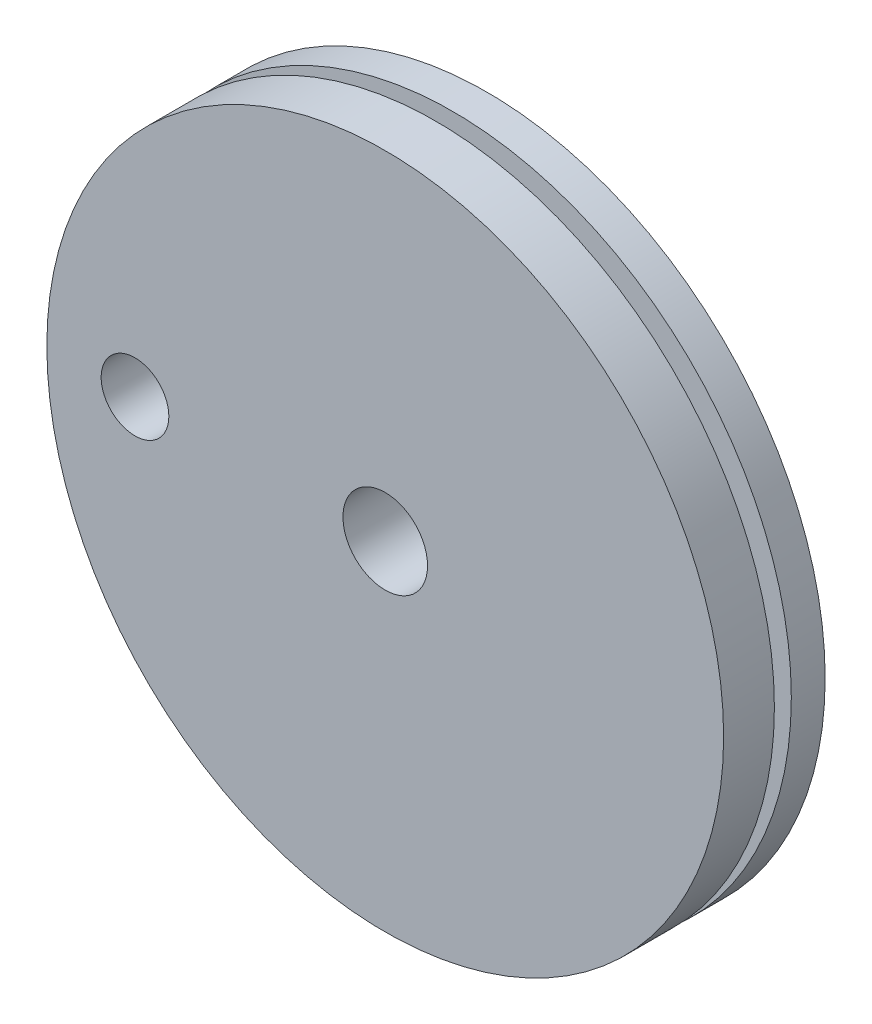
SolidWorks part; units mm, degrees
ref_plane "Plan de face" through (0, 0, 0) normal (0, 0, 1) x (1, 0, 0)
ref_plane "Plan de dessus" through (0, 0, 0) normal (0, 1, 0) x (1, 0, 0)
ref_plane "Plan de droite" through (0, 0, 0) normal (1, 0, 0) x (0, 0, -1)
sketch "Esquisse1" plane through (0, 0, 0) normal (0, 0, 1) x (1, 0, 0)
  circle A0 centre (0, 0) radius 20
  dimension "D1" = 40
extrude "Extrusion2" add sketch "Esquisse1" along normal blind 3
sketch "Esquisse2" plane through (0, 0, 3) normal (0, 0, 1) x (1, 0, 0)
  circle A0 centre (0, 0) radius 18.5
  dimension "D1" = 37
extrude "Enlèv. mat.-Extru.1" cut sketch "Esquisse2" against normal blind 1 flip side to cut
sketch "Esquisse3" plane through (0, 0, 3) normal (0, 0, 1) x (1, 0, 0)
  circle A0 centre (0, 0) radius 20
  dimension "D1" = 40
extrude "Extrusion3" add sketch "Esquisse3" along normal blind 3
sketch "Esquisse4" plane through (0, 0, 6) normal (0, 0, 1) x (1, 0, 0)
  circle A0 centre (0, 0) radius 2.5
  circle A1 centre (-14.7888, 0) radius 2
  dimension "D1" = 5
  dimension "D2" = 4
extrude "Enlèv. mat.-Extru.2" cut sketch "Esquisse4" against normal through all
